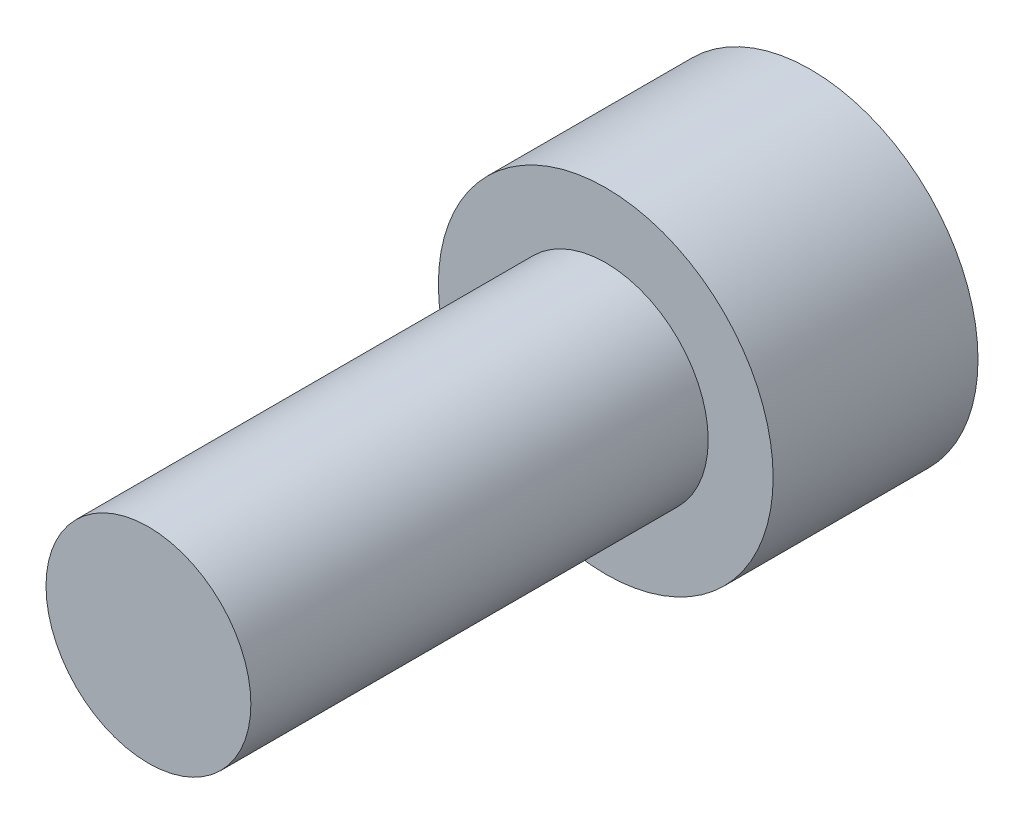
SolidWorks part; units mm, degrees
ref_plane "Front Plane" through (0, 0, 0) normal (0, 0, 1) x (1, 0, 0)
ref_plane "Top Plane" through (0, 0, 0) normal (0, 1, 0) x (1, 0, 0)
ref_plane "Right Plane" through (0, 0, 0) normal (1, 0, 0) x (0, 0, -1)
sketch "Sketch6" plane through (0, 0, 0) normal (1, 0, 0) x (0, 0, -1)
  line L0 (-6.35, 0) -> (22.525, 0) construction
  line L1 (2.5565, 0) -> (-2.5565, 0) construction
  line L2 (-6.35, 0) -> (-6.35, -1.4224)
  line L3 (-6.35, -1.4224) -> (0, -1.4224)
  line L4 (0, 2.5565) -> (0, -2.5565) construction
  line L5 (0, -1.4224) -> (0, -2.3241)
  line L6 (0, -2.3241) -> (2.8448, -2.3241)
  line L7 (2.8448, -2.3241) -> (2.8448, 0)
  line L8 (2.8448, 0) -> (-6.35, 0)
  dimension "L" = 6.35
  dimension "H" = 2.8448
  dimension "A" = 4.6482
  dimension "D" = 2.8448
revolve "Revolve1" add sketch "Sketch6" angle 360 about L0
sketch "Sketch7" plane through (0, 0, -2.8448) normal (0, 0, -1) x (-1, 0, 0)
  line L2 (-1.1811, 0.6819) -> (-1.1811, -0.6819)
  line L4 (-1.1811, -0.6819) -> (0, -1.3638)
  line L5 (0, -1.3638) -> (1.1811, -0.6819)
  line L6 (1.1811, -0.6819) -> (1.1811, 0.6819)
  line L7 (1.1811, 0.6819) -> (0, 1.3638)
  line L8 (0, 1.3638) -> (-1.1811, 0.6819)
  circle A0 centre (0, 0) radius 1.1811 construction
  dimension "J" = 2.3622
extrude "HEX" cut sketch "Sketch7" against normal blind 1.778
